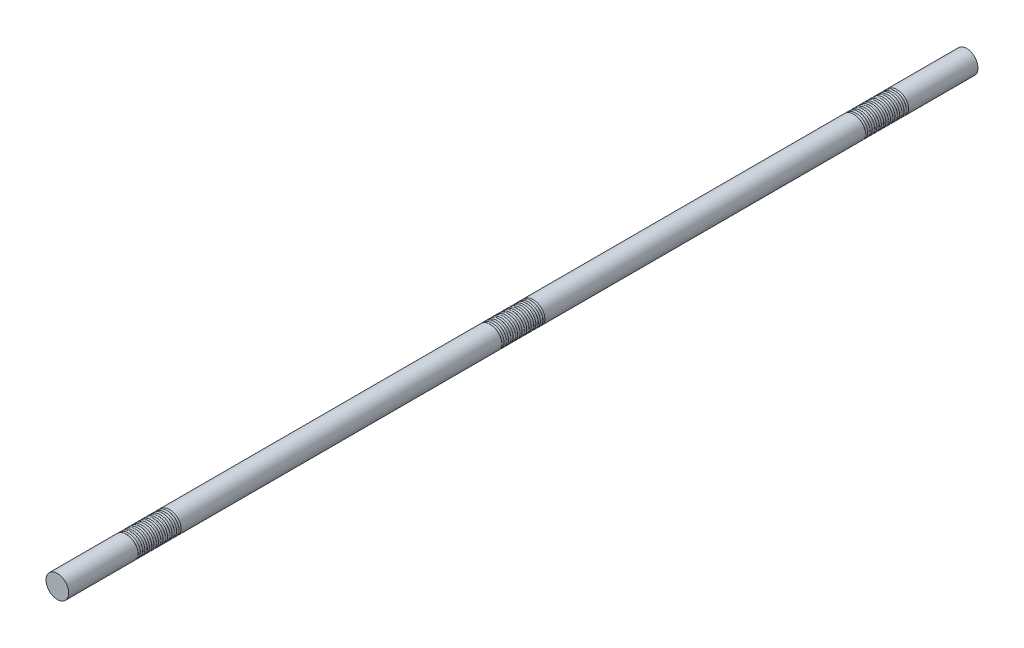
SolidWorks part; units mm, degrees
ref_plane "Front Plane" through (0, 0, 0) normal (0, 0, 1) x (1, 0, 0)
ref_plane "Top Plane" through (0, 0, 0) normal (0, 1, 0) x (1, 0, 0)
ref_plane "Right Plane" through (0, 0, 0) normal (1, 0, 0) x (0, 0, -1)
sketch "Sketch1" plane through (0, 0, 0) normal (0, 0, 1) x (1, 0, 0)
  circle A0 centre (0, 0) radius 25
  dimension "D1" = 50
extrude "Boss-Extrude1" add sketch "Sketch1" along normal blind 2000
ref_plane "Plane1" through (0, 0, 150) normal (0, 0, 1) x (1, 0, 0)
sketch "Sketch2" plane through (0, 0, 150) normal (0, 0, 1) x (1, 0, 0)
  circle A0 centre (0, 0) radius 27.1167
  dimension "D1" = 54.2333
curve "Helix/Spiral1"
sketch "Sketch3" plane through (0, 0, 0) normal (0, 1, 0) x (1, 0, 0)
  circle A0 centre (-27.1167, -150) radius 3.175
  spline S0 degree 3 number of poles 233 (-27.1167, -150) -> (-27.1167, -250) construction
  dimension "D1" = 6.35
sweep "Cut-Sweep1" cut profiles "Sketch3" path "Helix/Spiral1"
pattern_linear "LPattern1" count 3 spacing 800 along (0, 0, -1) of "Cut-Sweep1"
